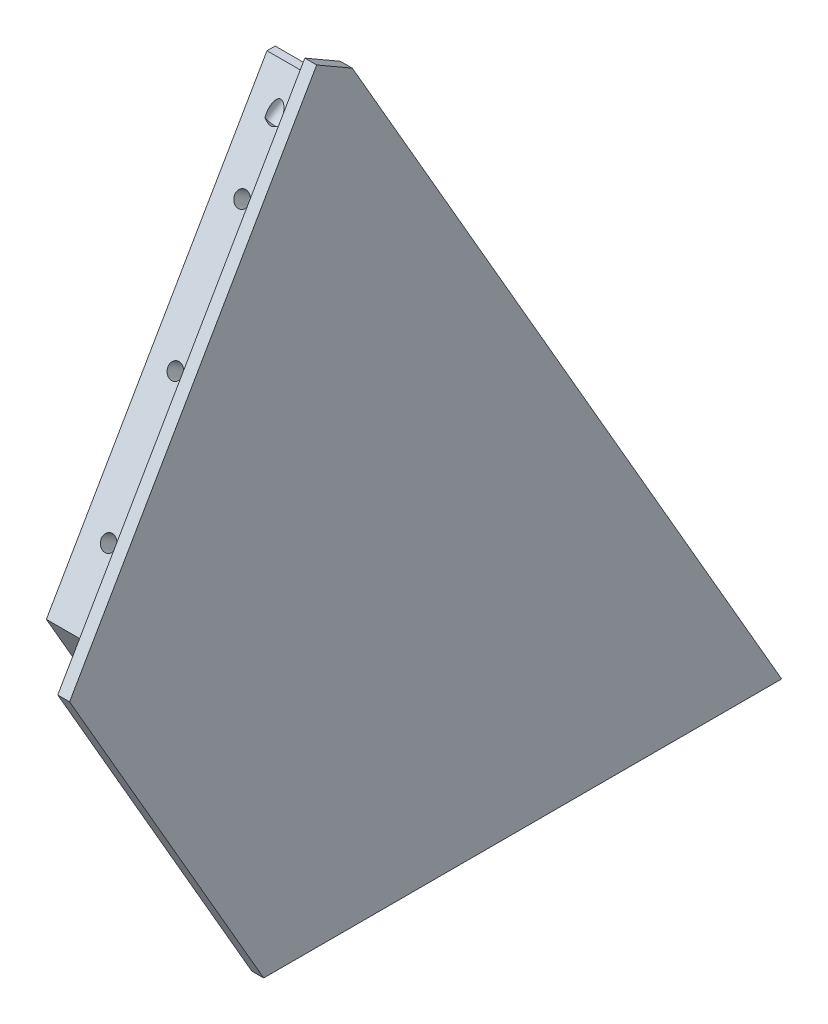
SolidWorks part; units mm, degrees
ref_plane "Front Plane" through (0, 0, 0) normal (0, 0, 1) x (1, 0, 0)
ref_plane "Top Plane" through (0, 0, 0) normal (0, 1, 0) x (1, 0, 0)
ref_plane "Right Plane" through (0, 0, 0) normal (1, 0, 0) x (0, 0, -1)
sketch "Sketch1" plane through (0, 0, 0) normal (1, 0, 0) x (0, 0, -1)
  line L0 (0, 0) -> (0, 78) construction
  line L1 (-41.5692, 102) -> (0, 78) construction
  line L2 (-41.5692, 102) -> (-67.7295, 56.6891)
  line L3 (-35, 0) -> (-67.7295, 56.6891)
  line L5 (-35, 0) -> (0, 0)
  line L6 (-41.5692, 102) -> (-24.0692, 132.3109)
  line L7 (-24.0692, 132.3109) -> (52.3205, 0)
  line L8 (0, 0) -> (52.3205, 0)
  line L9 (0, 78) -> (5.4654, 81.1554) construction
  line L10 (15.0008, 52.0197) -> (0, 78) construction
  line L11 (0, 78) -> (-17.5, 108.3109) construction
  line L14 (17.3017, 40.0343) -> (43.4791, 8) construction
  line L15 (45, 8) -> (-32, 8) construction
  dimension "D1" = 78
  dimension "D2" = 60
  dimension "D3" = 48
  dimension "D4" = 120
  dimension "D5" = 35
  dimension "D6" = 60
  dimension "D7" = 35
  dimension "D8" = 120
  dimension "D9" = 180
  dimension "D10" = 35
  dimension "D11" = 30
  dimension "D12" = 41.3696
extrude "Boss-Extrude1" add sketch "Sketch1" along normal blind 12
sketch "Sketch2" plane through (12, 0, 0) normal (1, 0, 0) x (0, 0, -1)
  line L0 (-26.0692, 128.8468) -> (-20.0692, 125.3827)
  line L1 (-24.0692, 132.3109) -> (-67.7295, 56.6891) construction
  line L2 (52.3205, 0) -> (-24.0692, 132.3109) construction
  line L3 (-20.0692, 125.3827) -> (-24.0692, 132.3109)
  line L4 (-24.0692, 132.3109) -> (-26.0692, 128.8468)
  dimension "D1" = 4
extrude "Cut-Extrude1" cut sketch "Sketch2" against normal through all
sketch "Sketch3" plane through (0, 0, 0) normal (-1, 0, 0) x (0, 0, 1)
  line L0 (26.0692, 128.8468) -> (27.0692, 127.1147)
  line L1 (26.0692, 128.8468) -> (67.7295, 56.6891) construction
  line L2 (27.0692, 127.1147) -> (21.5333, 123.9186)
  line L3 (21.5333, 123.9186) -> (-45, 8.6795)
  line L4 (-45, 8.6795) -> (-45, 0)
  line L5 (35, 0) -> (-52.3205, 0) construction
  line L6 (-45, 0) -> (-52.3205, 0)
  line L7 (-52.3205, 0) -> (20.0692, 125.3827)
  line L8 (20.0692, 125.3827) -> (26.0692, 128.8468)
  dimension "D1" = 2
  dimension "D2" = 2
  dimension "D3" = 45
extrude "Cut-Extrude2" cut sketch "Sketch3" against normal blind 10
sketch "Sketch4" [suppressed] plane through (12, 0, 0) normal (1, 0, 0) x (0, 0, -1)
  line L0 (-26.0692, 128.8468) -> (-27.0692, 127.1147)
  line L2 (-26.0692, 128.8468) -> (-67.7295, 56.6891) construction
  line L3 (-27.0692, 127.1147) -> (-21.5333, 123.9186)
  line L4 (-21.5333, 123.9186) -> (45, 8.6795)
  line L5 (45, 8.6795) -> (45, 0)
  line L6 (-35, 0) -> (52.3205, 0) construction
  line L7 (45, 0) -> (52.3205, 0)
  line L8 (52.3205, 0) -> (-20.0692, 125.3827)
  line L9 (-20.0692, 125.3827) -> (-26.0692, 128.8468)
  dimension "D1" = 2
  dimension "D2" = 2
  dimension "D3" = 45
extrude "Cut-Extrude3" [suppressed] cut sketch "Sketch4" against normal blind 10
sketch "Sketch5" plane through (0, 0, 0) normal (-1, 0, 0) x (0, 0, 1)
  line L0 (27.0692, 127.1147) -> (21.8731, 124.1147)
  line L1 (21.5333, 123.9186) -> (27.0692, 127.1147) construction
  line L2 (21.8731, 124.1147) -> (59.6466, 58.6891)
  line L3 (59.6466, 58.6891) -> (25.7624, 0)
  line L4 (35, 0) -> (-45, 0) construction
  line L5 (25.7624, 0) -> (35, 0)
  line L6 (35, 0) -> (67.7295, 56.6891)
  line L7 (67.7295, 56.6891) -> (27.0692, 127.1147)
  dimension "D1" = 6
  dimension "D2" = 8
extrude "Cut-Extrude4" cut sketch "Sketch5" against normal blind 10
sketch "Sketch6" [suppressed] plane through (12, 0, 0) normal (1, 0, 0) x (0, 0, -1)
  line L0 (-27.0692, 127.1147) -> (-21.8731, 124.1147)
  line L1 (-27.0692, 127.1147) -> (-21.5333, 123.9186) construction
  line L2 (-21.8731, 124.1147) -> (-59.6466, 58.6891)
  line L3 (-59.6466, 58.6891) -> (-25.7624, 0)
  line L4 (-35, 0) -> (45, 0) construction
  line L5 (-25.7624, 0) -> (-35, 0)
  line L6 (-35, 0) -> (-67.7295, 56.6891)
  line L7 (-67.7295, 56.6891) -> (-27.0692, 127.1147)
  dimension "D1" = 6
  dimension "D2" = 8
extrude "Cut-Extrude5" [suppressed] cut sketch "Sketch6" against normal blind 10
sketch "Sketch7" plane through (0, 0, 0) normal (-1, 0, 0) x (0, 0, 1)
  line L0 (-45, 0) -> (-45, 8)
  line L1 (-45, 0) -> (-45, 8.6795) construction
  line L2 (-45, 8) -> (31, 8)
  line L3 (31, 8) -> (31, 0)
  line L4 (25.7624, 0) -> (35, 0) construction
  line L5 (31, 0) -> (-45, 0)
  dimension "D1" = 8
  dimension "D2" = 76
extrude "Cut-Extrude6" cut sketch "Sketch7" against normal blind 10
sketch "Sketch8" [suppressed] plane through (12, 0, 0) normal (1, 0, 0) x (0, 0, -1)
  line L1 (45, 0) -> (-31, 0)
  line L2 (45, 0) -> (45, 8)
  line L3 (45, 8) -> (-31, 8)
  line L4 (-31, 0) -> (-31, 8)
  dimension "D1" = 8
  dimension "D2" = 76
extrude "Cut-Extrude7" [suppressed] cut sketch "Sketch8" against normal blind 10
sketch "Sketch11" plane through (0, 0, 0) normal (-1, 0, 0) x (0, 0, 1)
  line L0 (26.3786, 106.3109) -> (53.8731, 58.6891)
  line L1 (53.8731, 58.6891) -> (27.4944, 13)
  line L2 (27.4944, 13) -> (-27.4944, 13)
  line L4 (59.6466, 58.6891) -> (30.3812, 8) construction
  line L5 (21.8731, 124.1147) -> (59.6466, 58.6891) construction
  line L6 (26.3786, 106.3109) -> (-27.4944, 13)
  line L7 (30.3812, 8) -> (-45, 8) construction
  line L8 (20.0692, 125.3827) -> (-52.3205, 0) construction
  dimension "D1" = 5
  dimension "D2" = 5
  dimension "D3" = 5
  dimension "D4" = 15
extrude "Cut-Extrude8" cut sketch "Sketch11" against normal blind 9
sketch "Sketch13" plane through (0, 0, 0) normal (-1, 0, 0) x (0, 0, 1)
  line L0 (16.7716, 119.6711) -> (25.7004, 114.5161)
  line L1 (20.0692, 125.3827) -> (-52.3205, 0) construction
  line L2 (25.7004, 114.5161) -> (-21.7996, 32.2437)
  line L3 (-21.7996, 32.2437) -> (-30.7284, 37.3987)
  line L4 (-30.7284, 37.3987) -> (16.7716, 119.6711)
  line L5 (-21.7996, 32.2437) -> (-35.8083, 8) construction
  line L6 (30.3812, 8) -> (-45, 8) construction
  dimension "D1" = 10.31
  dimension "D2" = 95
  dimension "D3" = 28
extrude "Cut-Extrude9" cut sketch "Sketch13" against normal blind 6
sketch "Sketch14" [suppressed] plane through (12, 0, 0) normal (1, 0, 0) x (0, 0, -1)
  line L0 (-27.5333, 104.3109) -> (25.185, 13)
  line L1 (52.3205, 0) -> (-20.0692, 125.3827) construction
  line L2 (-21.5333, 123.9186) -> (45, 8.6795) construction
  line L3 (-27.5333, 104.3109) -> (-53.8731, 58.6891)
  line L4 (-53.8731, 58.6891) -> (-27.4944, 13)
  line L5 (-27.4944, 13) -> (25.185, 13)
  line L7 (45, 8) -> (-30.3812, 8) construction
  line L8 (-30.3812, 8) -> (-59.6466, 58.6891) construction
  line L9 (-59.6466, 58.6891) -> (-21.8731, 124.1147) construction
  dimension "D1" = 15
  dimension "D2" = 5
  dimension "D3" = 5
  dimension "D4" = 5
extrude "Cut-Extrude10" [suppressed] cut sketch "Sketch14" against normal blind 9
sketch "Sketch15" [suppressed] plane through (12, 0, 0) normal (1, 0, 0) x (0, 0, -1)
  line L0 (21.7967, 32.2487) -> (30.7255, 37.4037)
  line L1 (52.3205, 0) -> (-20.0692, 125.3827) construction
  line L2 (30.7255, 37.4037) -> (-16.7745, 119.6761)
  line L3 (-16.7745, 119.6761) -> (-25.7033, 114.5211)
  line L4 (-25.7033, 114.5211) -> (21.7967, 32.2487)
  line L5 (21.7967, 32.2487) -> (35.7967, 8) construction
  line L6 (45, 8) -> (-30.3812, 8) construction
  dimension "D1" = 95
  dimension "D2" = 10.31
  dimension "D3" = 28
extrude "Cut-Extrude11" [suppressed] cut sketch "Sketch15" against normal blind 6
sketch "Sketch16" plane through (0, 0, 0) normal (-1, 0, 0) x (0, 0, 1)
  line L0 (-45, 8) -> (-44, 8)
  line L1 (30.3812, 8) -> (-45, 8) construction
  line L2 (-44, 8) -> (-44, 10.4115)
  line L3 (-45, 8.6795) -> (21.5333, 123.9186) construction
  line L4 (-44, 10.4115) -> (-45, 8.6795)
  line L5 (-45, 8.6795) -> (-45, 8)
  dimension "D1" = 1
extrude "Cut-Extrude12" cut sketch "Sketch16" against normal blind 10
sketch "Sketch17" plane through (0, 0, 0) normal (-1, 0, 0) x (0, 0, 1)
  line L0 (22.4504, 123.1147) -> (21.0692, 123.1147)
  line L1 (21.8731, 124.1147) -> (59.6466, 58.6891) construction
  line L2 (18.5037, 118.6711) -> (21.5333, 123.9186) construction
  line L3 (21.0692, 123.1147) -> (21.5333, 123.9186)
  line L4 (21.5333, 123.9186) -> (21.8731, 124.1147)
  line L5 (21.8731, 124.1147) -> (22.4504, 123.1147)
  dimension "D1" = 1
extrude "Cut-Extrude13" cut sketch "Sketch17" against normal blind 10
sketch "Sketch19" [suppressed] plane through (12, 0, 0) normal (1, 0, 0) x (0, 0, -1)
  line L0 (44, 8) -> (44, 10.4115)
  line L1 (45, 8) -> (-30.3812, 8) construction
  line L2 (28.9934, 36.4037) -> (45, 8.6795) construction
  line L3 (44, 10.4115) -> (45, 8.6795)
  line L4 (45, 8.6795) -> (45, 8)
  line L5 (45, 8) -> (44, 8)
  dimension "D1" = 1
extrude "Cut-Extrude16" [suppressed] cut sketch "Sketch19" against normal blind 10
sketch "Sketch20" [suppressed] plane through (12, 0, 0) normal (1, 0, 0) x (0, 0, -1)
  line L0 (-22.4504, 123.1147) -> (-21.0692, 123.1147)
  line L1 (-59.6466, 58.6891) -> (-21.8731, 124.1147) construction
  line L2 (-21.5333, 123.9186) -> (-18.5066, 118.6761) construction
  line L3 (-21.0692, 123.1147) -> (-21.5333, 123.9186)
  line L4 (-21.5333, 123.9186) -> (-21.8731, 124.1147)
  line L5 (-21.8731, 124.1147) -> (-22.4504, 123.1147)
  dimension "D1" = 1
extrude "Cut-Extrude17" [suppressed] cut sketch "Sketch20" against normal blind 10
fillet "Fillet1" radius 5 2 edges at (3, 32.2437, -21.7996) (3, 114.5161, 25.7004)
fillet "Fillet2" radius 7.5 4 edges at (4.5, 13, 27.4944) (4.5, 58.6891, 53.8731) (4.5, 13, -27.4944) (4.5, 106.3109, 26.3786)
fillet "Fillet3" [suppressed] radius 7.5
fillet "Fillet4" [suppressed] radius 5
hole_wizard "M3x0.5 Tapped Hole1" positions "Sketch22" profile "Sketch21" tap size "M3x0.5" standard "ANSI Metric"
sketch "Sketch22" plane through (0, 8, 0) normal (0, -1, 0) x (-1, 0, 0)
  point P0 (-7.5, -20)
  point P3 (-7.5, 5)
  point P6 (-7.5, 35)
sketch "Sketch21" plane through (7.5, 8, 20) normal (1, 0, 0) x (0, 0, -1)
  line L0 (0, 0) -> (0, 9.2511)
  line L1 (0, 9.2511) -> (1.25, 8.5)
  line L2 (1.25, 8.5) -> (1.25, 0)
  line L5 (1.25, 0) -> (0, 0)
  line L10 (0, 9.2511) -> (-1.25, 8.5) construction
  line L11 (0, -6.35) -> (0, 107.95) construction
  dimension "Tap Drill Dia." = 2.5
  dimension "Tap Drill Depth" = 8.5
  dimension "Drill Angle" = 118
hole_wizard "M3x0.5 Tapped Hole2" positions "Sketch24" profile "Sketch23" tap size "M3x0.5" standard "ANSI Metric"
sketch "Sketch24" plane through (0, 8, 0) normal (0, -1, 0) x (-1, 0, 0)
  point P0 (-4.5, -20)
  point P3 (-4.5, 5)
  point P6 (-4.5, 35)
sketch "Sketch23" plane through (4.5, 8, 20) normal (1, 0, 0) x (0, 0, -1)
  line L0 (0, 0) -> (0, 9.2511)
  line L1 (0, 9.2511) -> (1.25, 8.5)
  line L2 (1.25, 8.5) -> (1.25, 0)
  line L5 (1.25, 0) -> (0, 0)
  line L10 (0, 9.2511) -> (-1.25, 8.5) construction
  line L11 (0, -6.35) -> (0, 107.95) construction
  dimension "Tap Drill Dia." = 2.5
  dimension "Tap Drill Depth" = 8.5
  dimension "Drill Angle" = 118
hole_wizard "Ø3.1 (3.1) Diameter Hole1" positions "Sketch26" profile "Sketch25" hole size "Ø3.1" standard "ANSI Metric"
sketch "Sketch26" plane through (0, -11.1554, 19.3218) normal (0, -0.5, 0.866) x (1, 0, 0)
  line L0 (7.5, 69.1188) -> (7.5, 34.1188) construction
  line L2 (2, 22.1188) -> (12, 22.1188) construction
  line L3 (2, 22.1188) -> (2, 80.6495) construction
  point P0 (7.5, 34.1188)
  point P2 (7.5, 69.1188)
  dimension "D1" = 12
  dimension "D2" = 35
  dimension "D3" = 5.5
sketch "Sketch25" plane through (7.5, 18.3923, 36.3812) normal (1, 0, 0) x (0, -0.866, -0.5)
  line L0 (0, 0) -> (0, 5.9303)
  line L1 (0, 5.9303) -> (1.55, 4.999)
  line L2 (1.55, 4.999) -> (1.55, 0)
  line L5 (1.55, 0) -> (0, 0)
  line L10 (0, 5.9303) -> (-1.55, 4.999) construction
  line L11 (0, -6.35) -> (0, 107.95) construction
  dimension "Hole Dia." = 3.1
  dimension "Hole Depth" = 4.999
  dimension "Drill Angle" = 118
hole_wizard "M3x0.5 Tapped Hole3" positions "Sketch30" profile "Sketch29" tap size "M3x0.5" standard "ANSI Metric"
sketch "Sketch30" plane through (0, 40.5, 70.1481) normal (0, 0.5, 0.866) x (1, 0, 0)
  line L0 (7.5, 55.503) -> (7.5, 33.003) construction
  line L2 (2, 21.003) -> (12, 21.003) construction
  line L3 (2, 21.003) -> (2, 95.3953) construction
  point P0 (7.5, 33.003)
  point P2 (7.5, 55.503)
  dimension "D1" = 12
  dimension "D2" = 22.5
  dimension "D3" = 5.5
sketch "Sketch29" plane through (7.5, 69.0814, 53.6466) normal (1, 0, 0) x (0, -0.866, 0.5)
  line L0 (0, 0) -> (0, 5)
  line L1 (0, 5) -> (1.25, 5)
  line L2 (1.25, 5) -> (1.25, 0)
  line L5 (1.25, 0) -> (0, 0)
  line L11 (0, -6.35) -> (0, 107.95) construction
  dimension "Thru Tap Drill Dia." = 2.5
  dimension "Thru Tap Drill Depth" = 5
hole_wizard "Ø3.1 (3.1) Diameter Hole2" positions "Sketch32" profile "Sketch31" hole size "Ø3.1" standard "ANSI Metric"
sketch "Sketch32" plane through (0, -11.1554, 19.3218) normal (0, -0.5, 0.866) x (1, 0, 0)
  line L0 (4.5, 69.1188) -> (4.5, 34.1188) construction
  line L2 (0, 22.1188) -> (10, 22.1188) construction
  line L3 (10, 17.5) -> (10, 82.9589) construction
  point P0 (4.5, 34.1188)
  point P2 (4.5, 69.1188)
  dimension "D1" = 12
  dimension "D2" = 35
  dimension "D3" = 5.5
sketch "Sketch31" plane through (4.5, 18.3923, 36.3812) normal (1, 0, 0) x (0, -0.866, -0.5)
  line L0 (0, 0) -> (0, 5)
  line L1 (0, 5) -> (1.55, 5)
  line L2 (1.55, 5) -> (1.55, 0)
  line L5 (1.55, 0) -> (0, 0)
  line L11 (0, -6.35) -> (0, 107.95) construction
  dimension "Thru Hole Dia." = 3.1
  dimension "Thru Hole Depth" = 5
hole_wizard "M3x0.5 Tapped Hole4" positions "Sketch34" profile "Sketch33" tap size "M3x0.5" standard "ANSI Metric"
sketch "Sketch34" plane through (0, 40.5, 70.1481) normal (0, 0.5, 0.866) x (1, 0, 0)
  line L0 (4.5, 55.503) -> (4.5, 33.003) construction
  line L2 (10, 21.003) -> (0, 21.003) construction
  line L7 (10, 95.3953) -> (10, 21.003) construction
  point P0 (4.5, 33.003)
  point P2 (4.5, 55.503)
  dimension "D1" = 12
  dimension "D2" = 22.5
  dimension "D3" = 5.5
sketch "Sketch33" plane through (4.5, 69.0814, 53.6466) normal (1, 0, 0) x (0, -0.866, 0.5)
  line L0 (0, 0) -> (0, 5)
  line L1 (0, 5) -> (1.25, 5)
  line L2 (1.25, 5) -> (1.25, 0)
  line L5 (1.25, 0) -> (0, 0)
  line L11 (0, -6.35) -> (0, 107.95) construction
  dimension "Thru Tap Drill Dia." = 2.5
  dimension "Thru Tap Drill Depth" = 5
hole_wizard "M3x0.5 Tapped Hole5" positions "Sketch36" profile "Sketch35" tap size "M3x0.5" standard "ANSI Metric"
sketch "Sketch36" plane through (0, 40.5, 70.1481) normal (0, 0.5, 0.866) x (1, 0, 0)
  line L0 (4.5, 78.003) -> (4.5, 55.503) construction
  point P0 (4.5, 78.003)
  dimension "D1" = 22.5
sketch "Sketch35" plane through (4.5, 108.0526, 31.1466) normal (1, 0, 0) x (0, -0.866, 0.5)
  line L0 (0, 0) -> (0, 9.2511)
  line L1 (0, 9.2511) -> (1.25, 8.5)
  line L2 (1.25, 8.5) -> (1.25, 0)
  line L5 (1.25, 0) -> (0, 0)
  line L10 (0, 9.2511) -> (-1.25, 8.5) construction
  line L11 (0, -6.35) -> (0, 107.95) construction
  dimension "Tap Drill Dia." = 2.5
  dimension "Tap Drill Depth" = 8.5
  dimension "Drill Angle" = 118
hole_wizard "M3x0.5 Tapped Hole6" positions "Sketch38" profile "Sketch37" tap size "M3x0.5" standard "ANSI Metric"
sketch "Sketch38" plane through (0, 40.5, 70.1481) normal (0, 0.5, 0.866) x (1, 0, 0)
  line L0 (7.5, 78.003) -> (7.5, 55.503) construction
  point P0 (7.5, 78.003)
  dimension "D1" = 22.5
sketch "Sketch37" plane through (7.5, 108.0526, 31.1466) normal (1, 0, 0) x (0, -0.866, 0.5)
  line L0 (0, 0) -> (0, 9.2511)
  line L1 (0, 9.2511) -> (1.25, 8.5)
  line L2 (1.25, 8.5) -> (1.25, 0)
  line L5 (1.25, 0) -> (0, 0)
  line L10 (0, 9.2511) -> (-1.25, 8.5) construction
  line L11 (0, -6.35) -> (0, 107.95) construction
  dimension "Tap Drill Dia." = 2.5
  dimension "Tap Drill Depth" = 8.5
  dimension "Drill Angle" = 118
hole_wizard "M3x0.5 Tapped Hole7" positions "Sketch40" profile "Sketch39" tap size "M3x0.5" standard "ANSI Metric"
sketch "Sketch40" plane through (0, 21.6554, -37.5083) normal (0, 0.5, -0.866) x (-1, 0, 0)
  point P0 (-4.5, 114.4382)
  point P3 (-4.5, 0.4382)
sketch "Sketch39" plane through (4.5, 120.7619, 19.7108) normal (1, 0, 0) x (0, 0.866, 0.5)
  line L0 (0, 0) -> (0, 8.2511)
  line L1 (0, 8.2511) -> (1.25, 7.5)
  line L2 (1.25, 7.5) -> (1.25, 0)
  line L5 (1.25, 0) -> (0, 0)
  line L10 (0, 8.2511) -> (-1.25, 7.5) construction
  line L11 (0, -6.35) -> (0, 107.95) construction
  dimension "Tap Drill Dia." = 2.5
  dimension "Tap Drill Depth" = 7.5
  dimension "Drill Angle" = 118
hole_wizard "M3x0.5 Tapped Hole8" positions "Sketch42" profile "Sketch41" tap size "M3x0.5" standard "ANSI Metric"
sketch "Sketch42" plane through (0, 21.6554, -37.5083) normal (0, 0.5, -0.866) x (-1, 0, 0)
  point P0 (-7, 114.4382)
  point P3 (-7, 0.4382)
sketch "Sketch41" plane through (7, 120.7619, 19.7108) normal (1, 0, 0) x (0, 0.866, 0.5)
  line L0 (0, 0) -> (0, 8.2511)
  line L1 (0, 8.2511) -> (1.25, 7.5)
  line L2 (1.25, 7.5) -> (1.25, 0)
  line L5 (1.25, 0) -> (0, 0)
  line L10 (0, 8.2511) -> (-1.25, 7.5) construction
  line L11 (0, -6.35) -> (0, 107.95) construction
  dimension "Tap Drill Dia." = 2.5
  dimension "Tap Drill Depth" = 7.5
  dimension "Drill Angle" = 118
hole_wizard "M3x0.5 Tapped Hole9" positions "Sketch44" profile "Sketch43" tap size "M3x0.5" standard "ANSI Metric"
sketch "Sketch44" plane through (0, 17.5004, -30.3117) normal (0, 0.5, -0.866) x (-1, 0, 0)
  point P0 (-2.25, 88.0198)
  point P3 (-2.25, 38.0198)
sketch "Sketch43" plane through (2.25, 93.7279, 13.6983) normal (1, 0, 0) x (0, 0.866, 0.5)
  line L0 (0, 0) -> (0, 4.69)
  line L1 (0, 4.69) -> (1.25, 4.69)
  line L2 (1.25, 4.69) -> (1.25, 0)
  line L5 (1.25, 0) -> (0, 0)
  line L11 (0, -6.35) -> (0, 107.95) construction
  dimension "Thru Tap Drill Dia." = 2.5
  dimension "Thru Tap Drill Depth" = 4.69
hole_wizard "M3x0.5 Tapped Hole10" positions "Sketch46" profile "Sketch45" tap size "M3x0.5" standard "ANSI Metric"
sketch "Sketch46" plane through (0, 17.5004, -30.3117) normal (0, 0.5, -0.866) x (-1, 0, 0)
  point P0 (-9.75, 38.0298)
  point P3 (-9.75, 93.0298)
sketch "Sketch45" plane through (9.75, 50.4352, -11.2967) normal (1, 0, 0) x (0, 0.866, 0.5)
  line L0 (0, 0) -> (0, 6.69)
  line L1 (0, 6.69) -> (1.25, 6.69)
  line L2 (1.25, 6.69) -> (1.25, 0)
  line L5 (1.25, 0) -> (0, 0)
  line L11 (0, -6.35) -> (0, 107.95) construction
  dimension "Thru Tap Drill Dia." = 2.5
  dimension "Thru Tap Drill Depth" = 6.69
